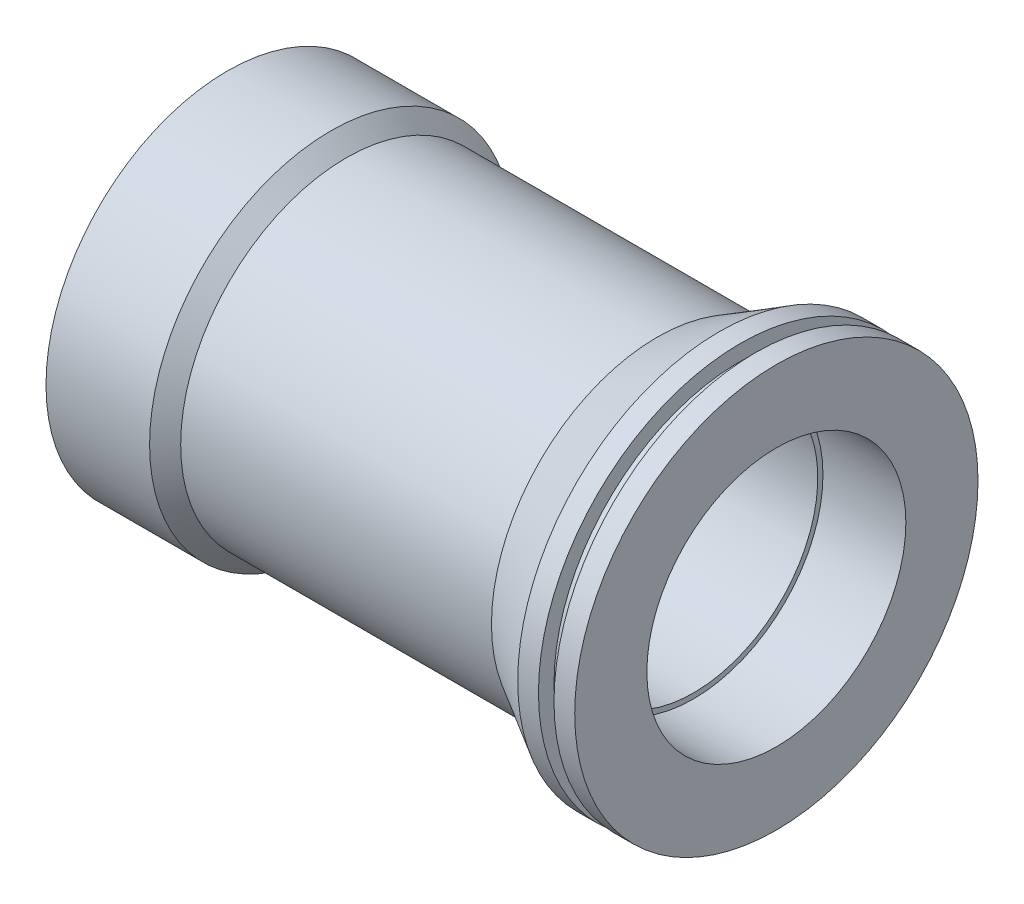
SolidWorks part; units mm, degrees
ref_plane "Plan de face" through (0, 0, 0) normal (0, 0, 1) x (1, 0, 0)
ref_plane "Plan de dessus" through (0, 0, 0) normal (0, 1, 0) x (1, 0, 0)
ref_plane "Plan de droite" through (0, 0, 0) normal (1, 0, 0) x (0, 0, -1)
sketch "Esquisse2" plane through (0, 0, 0) normal (0, 0, 1) x (1, 0, 0)
  line L0 (-89.2079, 0) -> (100.021, 0) construction
  line L1 (88.4065, 38.9282) -> (84.4065, 38.9282)
  line L2 (84.4065, 38.9282) -> (84.4065, 35.9282)
  line L3 (84.4065, 35.9282) -> (81.4065, 35.9282)
  line L4 (81.4065, 35.9282) -> (81.4065, 38.9282)
  line L5 (81.4065, 38.9282) -> (77.4065, 38.9282)
  line L6 (77.4065, 38.9282) -> (65.4065, 32)
  line L7 (65.4065, 32) -> (5.4065, 32)
  line L8 (5.4065, 32) -> (2.4065, 35)
  line L9 (2.4065, 35) -> (-17.5935, 35)
  line L10 (-17.5935, 35) -> (-17.5935, 30)
  line L11 (-17.5935, 30) -> (-2.5935, 30)
  line L12 (-2.5935, 30) -> (-2.5935, 22)
  line L13 (-2.5935, 22) -> (7.4065, 22)
  line L14 (7.4065, 22) -> (7.4065, 23)
  line L15 (7.4065, 23) -> (27.4065, 23)
  line L16 (27.4065, 23) -> (27.4065, 24)
  line L17 (27.4065, 24) -> (72.4065, 24)
  line L18 (72.4065, 24) -> (72.4065, 25)
  line L19 (72.4065, 25) -> (88.4065, 25)
  line L20 (88.4065, 25) -> (88.4065, 38.9282)
  dimension "D1" = 4
  dimension "D2" = 3
  dimension "D3" = 3
  dimension "D4" = 3
  dimension "D5" = 4
  dimension "D6" = 30
  dimension "D7" = 60
  dimension "D8" = 12
  dimension "D9" = 3
  dimension "D10" = 20
  dimension "D11" = 45
  dimension "D12" = 5
  dimension "D13" = 15
  dimension "D14" = 8
  dimension "D15" = 10
  dimension "D16" = 1
  dimension "D17" = 20
  dimension "D18" = 45
  dimension "D19" = 1
  dimension "D20" = 25
  dimension "D21" = 1
revolve "Révolution1" add sketch "Esquisse2" angle 360 about L0
